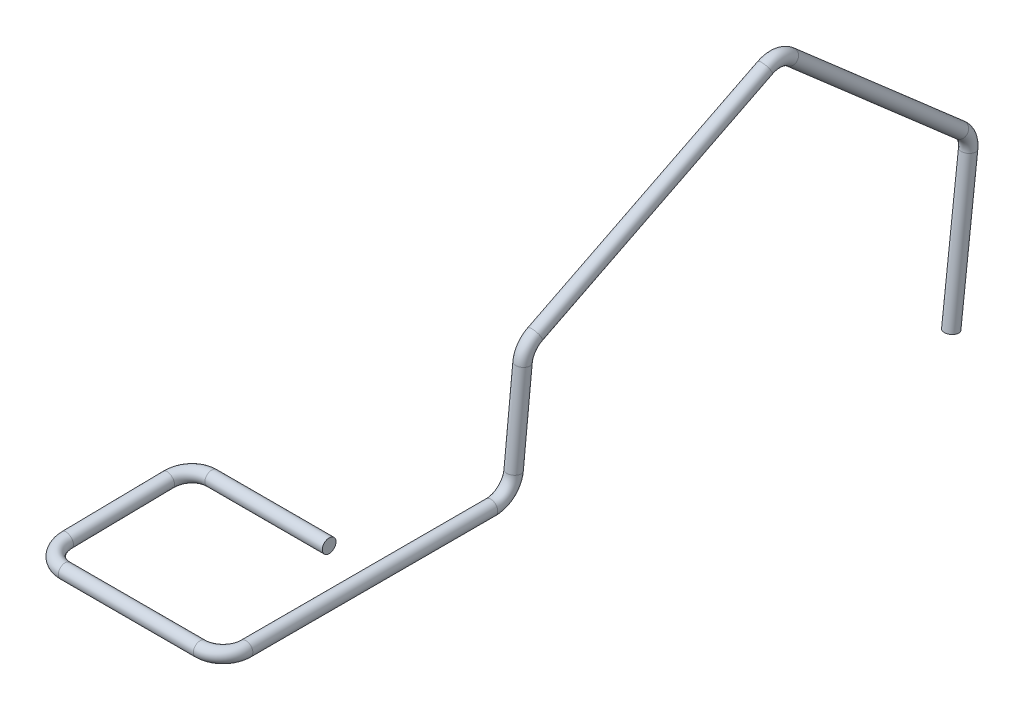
SolidWorks part; units mm, degrees
ref_plane "Front Plane" through (0, 0, 0) normal (0, 0, 1) x (1, 0, 0)
ref_plane "Top Plane" through (0, 0, 0) normal (0, 1, 0) x (1, 0, 0)
ref_plane "Right Plane" through (0, 0, 0) normal (1, 0, 0) x (0, 0, -1)
sketch "Sketch2" plane through (0, 0, 0) normal (0, 1, 0) x (1, 0, 0)
  line L0 (0, 0) -> (-15.24, 0)
  dimension "D1" = 15.24
sketch "Sketch3" plane through (0, 0, 0) normal (1, 0, 0) x (0, 0, -1)
  line L0 (24.003, 0) -> (25.019, 10.16)
  line L1 (25.019, 10.16) -> (46.228, 20.828)
  line L2 (46.228, 20.828) -> (62.103, 6.985)
  line L3 (62.103, 6.985) -> (60.579, -6.35)
  line L4 (24.003, 0) -> (0, 0)
  dimension "D1" = 24.003
  dimension "D2" = 10.16
  dimension "D3" = 1.016
  dimension "D4" = 22.225
  dimension "D5" = 20.828
  dimension "D6" = 38.1
  dimension "D7" = 6.985
  dimension "D8" = 6.35
  dimension "D9" = 36.576
ref_plane "Plane1" through (0, 1.3462, 0) normal (0, 1, 0) x (1, 0, 0)
sketch "Sketch4" plane through (0, 1.3462, 0) normal (0, 1, 0) x (1, 0, 0)
  line L0 (-14.097, 11.43) -> (-2.6035, 11.43)
  line L1 (0, 0) -> (-15.24, 0) construction
  line L2 (0, 0) -> (-15.24, 0) construction
  dimension "D1" = 11.43
  dimension "D2" = 2.6035
  dimension "D3" = 1.143
sketch3d "3DSketch3"
  line L0 (-2.6035, 1.3462, -11.43) -> (-12.3718, 1.3462, -11.43)
  line L1 (-14.2675, 1.1454, -9.7251) -> (-15.0321, 0.2448, -2.0789)
  line L2 (-13.1364, 0, 0) -> (-1.905, 0, 0)
  line L3 (0, 0, -1.905) -> (0, 0, -22.279)
  line L4 (0, 1.7154, -24.1745) -> (0, 9.1182, -24.9148)
  line L5 (0, 10.6305, -25.9543) -> (0, 20.2529, -45.0846)
  line L6 (0, 19.9868, -47.1926) -> (0, 7.6428, -61.3487)
  line L7 (0, 20.828, -46.228) -> (0, 6.985, -62.103) construction
  line L8 (0, 5.9907, -61.9894) -> (0, -6.35, -60.579)
  line L9 (0, 6.985, -62.103) -> (0, -6.35, -60.579) construction
  arc A0 (-12.3718, 1.3462, -11.43) -> (-14.2675, 1.1454, -9.7251) centre (-12.3718, 1.1234, -9.5381) ccw
  arc A1 (-15.0321, 0.2448, -2.0789) -> (-13.1364, 0, 0) centre (-13.1364, 0.2228, -1.8919) ccw
  arc A2 (-1.905, 0, 0) -> (0, 0, -1.905) centre (-1.905, 0, -1.905) ccw
  arc A3 (0, 0, -22.279) -> (0, 1.7154, -24.1745) centre (0, 1.905, -22.279) ccw
  arc A4 (0, 9.1182, -24.9148) -> (0, 10.6305, -25.9543) centre (0, 8.9286, -26.8104) ccw
  arc A5 (0, 20.2529, -45.0846) -> (0, 19.9868, -47.1926) centre (0, 18.551, -45.9406) ccw
  arc A6 (0, 7.6428, -61.3487) -> (0, 5.9907, -61.9894) centre (0, 6.207, -60.0967) ccw
  point P21 (-14.097, 1.3462, -11.43)
  point P22 (-12.3718, 3.0153, -9.3153)
  point P25 (-15.24, 0, 0)
  point P26 (-13.1364, 2.1147, -1.6691)
  point P29 (0, 0, 0)
  point P30 (-1.905, 1.905, -1.905)
  point P33 (0, 0, -24.003)
  point P34 (1.905, 1.905, -22.279)
  point P37 (0, 10.16, -25.019)
  point P38 (-1.905, 8.9286, -26.8104)
  point P41 (0, 20.828, -46.228)
  point P42 (-1.905, 18.551, -45.9406)
  point P45 (0, 6.985, -62.103)
  point P46 (-1.905, 6.207, -60.0967)
  dimension "D1" = 1.905
ref_plane "Plane2" through (-2.6035, 1.3462, -11.43) normal (1, 0, 0) x (0, 0, -1)
sketch "Sketch5" plane through (-2.6035, 1.3462, -11.43) normal (1, 0, 0) x (0, 0, -1)
  circle A0 centre (0, 0) radius 0.5715
  dimension "D1" = 1.143
sweep "Sweep1" add profiles "Sketch5" path "3DSketch3"
